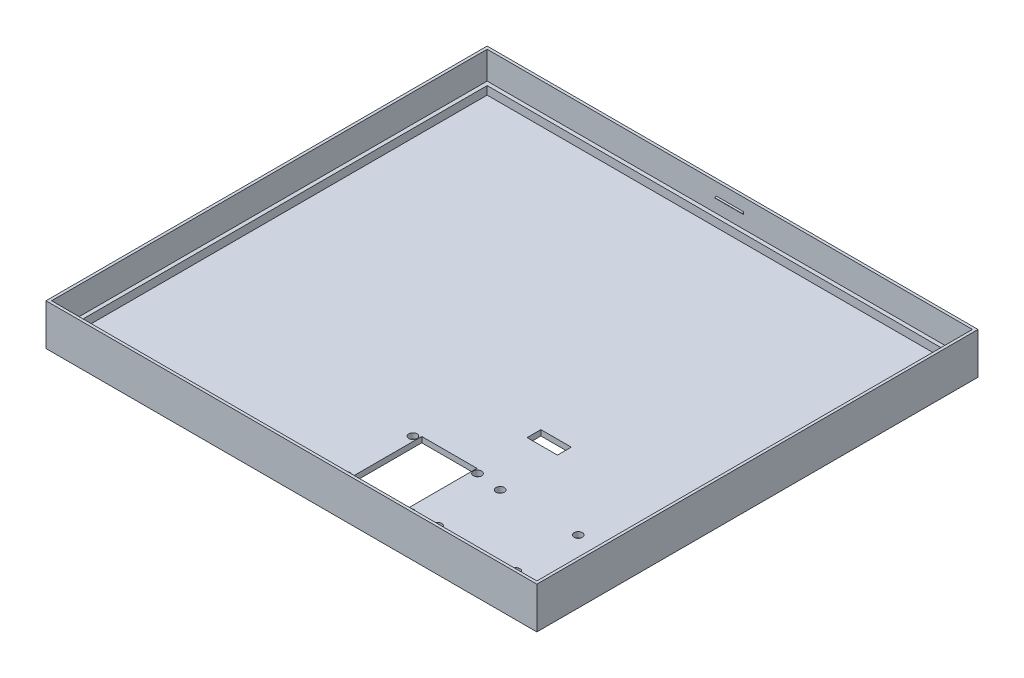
SolidWorks part; units mm, degrees
ref_plane "前视基准面" through (0, 0, 0) normal (0, 0, 1) x (1, 0, 0)
ref_plane "上视基准面" through (0, 0, 0) normal (0, 1, 0) x (1, 0, 0)
ref_plane "右视基准面" through (0, 0, 0) normal (1, 0, 0) x (0, 0, -1)
other "Configuration Table"
sketch "草图1" plane through (0, 0, 0) normal (0, 1, 0) x (1, 0, 0)
  line L1 (0, 0) -> (177.8, 0)
  line L2 (0, 0) -> (0, 159.8)
  line L3 (0, 159.8) -> (177.8, 159.8)
  line L4 (177.8, 0) -> (177.8, 159.8)
  dimension "D1" = 177.8
  dimension "D2" = 159.8
extrude "凸台-拉伸1" add sketch "草图1" along normal blind 15
sketch "草图3" plane through (0, 15, 0) normal (0, 1, 0) x (1, 0, 0)
  line L0 (0, 0) -> (177.8, 159.8)
  line L2 (2.4, 2.4) -> (175.4, 2.4)
  line L3 (2.4, 2.4) -> (2.4, 157.4)
  line L4 (2.4, 157.4) -> (175.4, 157.4)
  line L5 (175.4, 2.4) -> (175.4, 157.4)
  line L6 (2.4, 2.4) -> (175.4, 157.4) construction
  line L7 (2.4, 157.4) -> (175.4, 2.4) construction
  point P2 (88.9, 79.9)
  dimension "D1" = 173
  dimension "D2" = 155
extrude "切除-拉伸1" cut sketch "草图3" against normal blind 13 contours L2 L5 L4 L3
sketch "草图4" plane through (0, 2, 0) normal (0, 1, 0) x (1, 0, 0)
  line L0 (0, 0) -> (177.8, 159.8)
  line L2 (1, 1) -> (176.8, 1)
  line L3 (1, 1) -> (1, 158.8)
  line L4 (1, 158.8) -> (176.8, 158.8)
  line L5 (176.8, 1) -> (176.8, 158.8)
  line L6 (1, 1) -> (176.8, 158.8) construction
  line L7 (1, 158.8) -> (176.8, 1) construction
  point P4 (88.9, 79.9)
  dimension "D1" = 175.8
  dimension "D2" = 157.8
sketch "草图5" plane through (0, 15, 0) normal (0, 1, 0) x (1, 0, 0)
  line L1 (1, 158.8) -> (176.8, 158.8)
  line L2 (1, 158.8) -> (1, 1)
  line L3 (1, 1) -> (176.8, 1)
  line L4 (176.8, 158.8) -> (176.8, 1)
extrude "切除-拉伸2" cut sketch "草图5" against normal blind 10
ref_plane "基准面1" through (88.9, 0, 0) normal (-1, 0, 0) x (0, 0, 1)
sketch "草图7" plane through (88.9, 0, 0) normal (-1, 0, 0) x (0, 0, 1)
  line L0 (-158.8, 10) -> (-158.8, 9.56)
  line L1 (-158.8, 5) -> (-158.8, 15) construction
  line L2 (-158.8, 10) -> (-158.8, 10.44)
  line L4 (-158.8, 10.44) -> (-158.36, 10)
  line L5 (-158.8, 9.56) -> (-158.36, 10)
extrude "凸台-拉伸2" add sketch "草图7" against normal blind 5 and the other way blind 5
fillet "圆角11" radius 0.1 1 edges at (88.9, 10, -158.36)
ref_plane "基准面2" through (0, 0, -79.9) normal (0, 0, 1) x (1, 0, 0)
mirror "镜向1" about plane through (0, 0, -79.9) normal (0, 0, 1) of "凸台-拉伸2"
sketch "草图10" plane through (176.8, 0, 0) normal (-1, 0, 0) x (0, 0, 1)
  line L0 (-66.7237, 13.1076) -> (-66.7237, 12.6676)
  line L1 (-66.7237, 8.1076) -> (-66.7237, 18.1076) construction
  line L2 (-66.7237, 13.1076) -> (-66.7237, 13.5476)
  line L4 (-66.7237, 13.5476) -> (-66.2837, 13.1076)
  line L5 (-66.7237, 12.6676) -> (-66.2837, 13.1076)
fillet "圆角12" radius 0.1 1 edges at (88.9, 10, -1.44)
sketch "草图12" plane through (0, 0, 0) normal (0, -1, 0) x (1, 0, 0)
  line L0 (97.6291, -11.1808) -> (97.6291, -12.6808)
  line L1 (97.6291, -38.4808) -> (117.6291, -38.4808)
  line L2 (97.6291, -38.4808) -> (97.6291, -11.1808)
  line L3 (97.6291, -11.1808) -> (117.6291, -11.1808)
  line L4 (117.6291, -38.4808) -> (117.6291, -11.1808)
  line L6 (97.6291, -38.4808) -> (97.6291, -36.9808)
  line L7 (117.6291, -36.9808) -> (119.3291, -36.9808)
  circle A0 centre (95.9291, -12.6808) radius 1.5
  circle A1 centre (95.9291, -36.9808) radius 1.5
  circle A2 centre (119.3291, -36.9808) radius 1.5
  circle A3 centre (119.3291, -12.6808) radius 1.5
  dimension "D4" = 1.5
  dimension "D5" = 1.7
  dimension "D1" = 27.3
  dimension "D2" = 20
  dimension "D3" = 1.7
extrude "切除-拉伸4" cut sketch "草图12" against normal blind 2
sketch "草图14" plane through (0, 0, 0) normal (0, -1, 0) x (1, 0, 0)
  line L0 (160.8821, -35.9166) -> (156.8821, -35.9166)
  line L1 (126.8821, -37.6166) -> (160.8821, -37.6166)
  line L2 (126.8821, -37.6166) -> (126.8821, -11.6166)
  line L3 (126.8821, -11.6166) -> (160.8821, -11.6166)
  line L4 (160.8821, -37.6166) -> (160.8821, -11.6166)
  line L5 (126.8821, -37.6166) -> (128.5821, -37.6166)
  line L6 (126.8821, -37.6166) -> (126.8821, -35.9166)
  line L7 (126.8821, -35.9166) -> (128.5821, -35.9166)
  line L8 (128.5821, -37.6166) -> (128.5821, -35.9166)
  line L9 (126.8821, -11.6166) -> (128.5821, -11.6166)
  line L10 (126.8821, -11.6166) -> (126.8821, -13.3166)
  line L11 (126.8821, -13.3166) -> (128.5821, -13.3166)
  line L12 (128.5821, -11.6166) -> (128.5821, -13.3166)
  circle A0 centre (128.5821, -35.9166) radius 1.5
  circle A1 centre (128.5821, -13.3166) radius 1.5
  circle A2 centre (156.8821, -35.9166) radius 1.5
  circle A3 centre (156.8821, -13.3166) radius 1.5
  dimension "D5" = 1.7
  dimension "D6" = 4
  dimension "D1" = 26
  dimension "D2" = 34
  dimension "D3" = 1.7
  dimension "D4" = 1.7
extrude "切除-拉伸5" cut sketch "草图14" against normal blind 2
sketch "草图15" plane through (0, 0, 0) normal (0, -1, 0) x (1, 0, 0)
  line L1 (166.9404, -32.4363) -> (169.9404, -32.4363)
  line L2 (166.9404, -32.4363) -> (166.9404, -16.4363)
  line L3 (166.9404, -16.4363) -> (169.9404, -16.4363)
  line L4 (169.9404, -32.4363) -> (169.9404, -16.4363)
  dimension "D1" = 16
  dimension "D2" = 3
extrude "切除-拉伸6" cut sketch "草图15" against normal blind 2 contours L2 L1 L4 L3
sketch "草图16" plane through (0, 0, 0) normal (0, -1, 0) x (1, 0, 0)
  line L1 (117.0601, -62.2095) -> (128.0601, -62.2095)
  line L2 (117.0601, -62.2095) -> (117.0601, -57.2095)
  line L3 (117.0601, -57.2095) -> (128.0601, -57.2095)
  line L4 (128.0601, -62.2095) -> (128.0601, -57.2095)
extrude "切除-拉伸7" cut sketch "草图16" against normal blind 2
